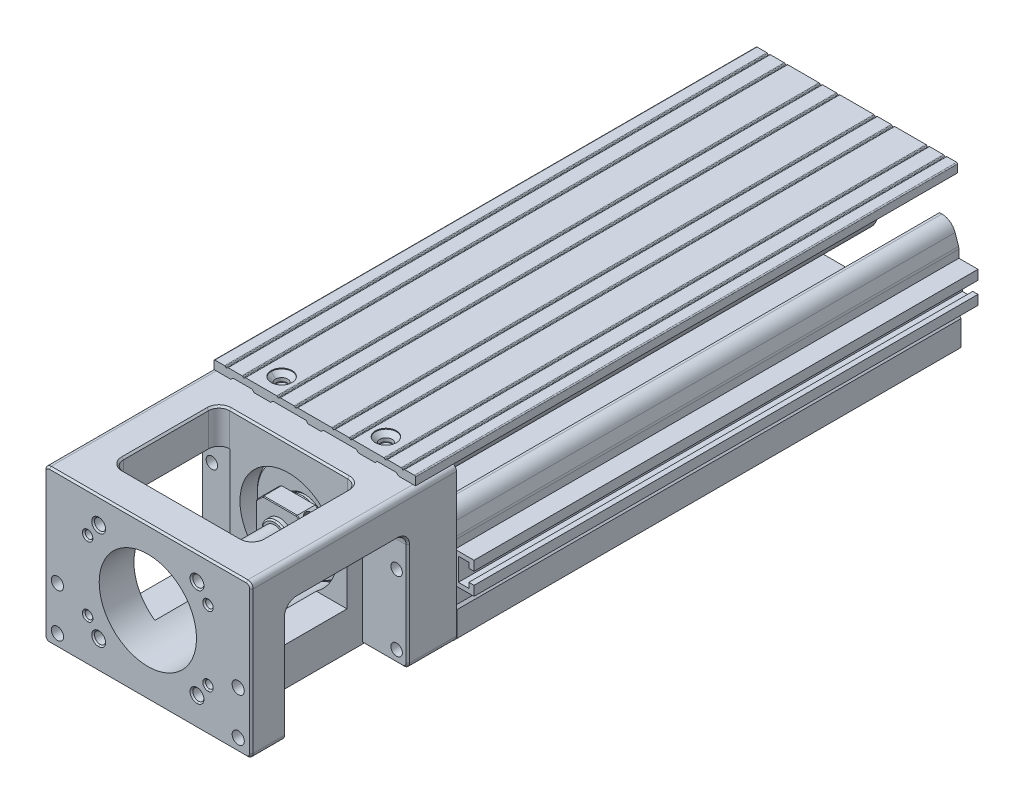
SolidWorks part; units mm, degrees
ref_plane "前视基准面" through (0, 0, 0) normal (0, 0, 1) x (1, 0, 0)
ref_plane "上视基准面" through (0, 0, 0) normal (0, 1, 0) x (1, 0, 0)
ref_plane "右视基准面" through (0, 0, 0) normal (1, 0, 0) x (0, 0, -1)
imported_body "输入1"
sketch "草图1" plane through (0, 0, 90) normal (0, 0, -1) x (-1, 0, 0)
  line L0 (-20.9243, 47) -> (-24.8757, 47) construction
  line L1 (-25.0879, 46.9121) -> (-25.2586, 46.7414) construction
  line L2 (-25.5414, 46.7414) -> (-25.7121, 46.9121) construction
  line L3 (-25.9243, 47) -> (-28.7, 47) construction
  line L4 (-29, 46.7) -> (-29, 44.5) construction
  line L5 (-29, 44.5) -> (-24.1, 44.5) construction
  line L6 (-24.1, 44.5) -> (-23.5, 45.1) construction
  line L7 (-23.5, 45.1) -> (-18, 45.1) construction
  line L8 (-18, 45.1) -> (-17.4, 44.5) construction
  line L9 (-17.4, 44.5) -> (-12.6, 44.5) construction
  line L10 (-12.6, 44.5) -> (-12, 45.1) construction
  line L11 (-12, 45.1) -> (-2.5, 45.1) construction
  line L12 (-2.5, 45.1) -> (-1.9, 44.5) construction
  line L13 (-1.9, 44.5) -> (1.9, 44.5) construction
  line L14 (1.9, 44.5) -> (2.5, 45.1) construction
  line L15 (2.5, 45.1) -> (12, 45.1) construction
  line L16 (12, 45.1) -> (12.6, 44.5) construction
  line L17 (12.6, 44.5) -> (17.4, 44.5) construction
  line L18 (17.4, 44.5) -> (18, 45.1) construction
  line L19 (18, 45.1) -> (23.5, 45.1) construction
  line L20 (23.5, 45.1) -> (24.1, 44.5) construction
  line L21 (24.1, 44.5) -> (29, 44.5) construction
  line L22 (29, 44.5) -> (29, 46.7) construction
  line L23 (28.7, 47) -> (25.9243, 47) construction
  line L24 (25.7121, 46.9121) -> (25.5414, 46.7414) construction
  line L25 (25.2586, 46.7414) -> (25.0879, 46.9121) construction
  line L26 (24.8757, 47) -> (20.9243, 47) construction
  line L27 (20.7121, 46.9121) -> (20.5414, 46.7414) construction
  line L28 (20.2586, 46.7414) -> (20.0879, 46.9121) construction
  line L29 (19.8757, 47) -> (10.9243, 47) construction
  line L30 (10.7121, 46.9121) -> (10.5414, 46.7414) construction
  line L31 (10.2586, 46.7414) -> (10.0879, 46.9121) construction
  line L32 (9.8757, 47) -> (5.9243, 47) construction
  line L33 (5.7121, 46.9121) -> (5.5414, 46.7414) construction
  line L34 (5.2586, 46.7414) -> (5.0879, 46.9121) construction
  line L35 (4.8757, 47) -> (-4.8757, 47) construction
  line L36 (-5.0879, 46.9121) -> (-5.2586, 46.7414) construction
  line L37 (-5.5414, 46.7414) -> (-5.7121, 46.9121) construction
  line L38 (-5.9243, 47) -> (-9.8757, 47) construction
  line L39 (-10.0879, 46.9121) -> (-10.2586, 46.7414) construction
  line L40 (-10.5414, 46.7414) -> (-10.7121, 46.9121) construction
  line L41 (-10.9243, 47) -> (-19.8757, 47) construction
  line L42 (-20.0879, 46.9121) -> (-20.2586, 46.7414) construction
  line L43 (-20.5414, 46.7414) -> (-20.7121, 46.9121) construction
  line L44 (-30, 8.7) -> (-30, 1.5) construction
  line L45 (-30, 1.5) -> (-29, 0.5) construction
  line L46 (-29, 0.5) -> (-25, 0.5) construction
  line L47 (-25, 0.5) -> (-24.5, 0) construction
  line L48 (-24.5, 0) -> (-9.5, 0) construction
  line L49 (-9.5, 0) -> (-9, 0.5) construction
  line L50 (-9, 0.5) -> (9, 0.5) construction
  line L51 (9, 0.5) -> (9.5, 0) construction
  line L52 (9.5, 0) -> (24.5, 0) construction
  line L53 (24.5, 0) -> (25, 0.5) construction
  line L54 (25, 0.5) -> (29, 0.5) construction
  line L55 (29, 0.5) -> (30, 1.5) construction
  line L56 (30, 1.5) -> (30, 8.7) construction
  line L57 (30, 8.7) -> (29.35, 9.35) construction
  line L58 (29.35, 9.35) -> (29.35, 14.4) construction
  line L59 (29.35, 14.4) -> (34.85, 14.4) construction
  line L60 (34.85, 14.4) -> (34.85, 17.15) construction
  line L61 (34.85, 17.15) -> (33.35, 17.15) construction
  line L62 (33.35, 17.15) -> (33.35, 15.65) construction
  line L63 (33.35, 15.65) -> (30.35, 15.65) construction
  line L64 (30.35, 15.65) -> (30.35, 22.15) construction
  line L65 (30.35, 22.15) -> (33.35, 22.15) construction
  line L66 (33.35, 22.15) -> (33.35, 20.65) construction
  line L67 (33.35, 20.65) -> (34.85, 20.65) construction
  line L68 (34.85, 20.65) -> (34.85, 23.4) construction
  line L69 (34.85, 23.4) -> (29.35, 23.4) construction
  line L70 (29.35, 23.4) -> (29.35, 25.6754) construction
  line L71 (29.2474, 26.3079) -> (28.2617, 29.2649) construction
  line L72 (24.467, 32) -> (23.8, 32) construction
  line L73 (23.8, 32) -> (23.8, 22.4) construction
  line L74 (23.8, 22.4) -> (23.45, 22.4) construction
  line L75 (23.45, 22.4) -> (22.45, 21.4) construction
  line L76 (22.45, 21.4) -> (21.45, 22.4) construction
  line L77 (21.45, 22.4) -> (20.15, 22.4) construction
  line L78 (20.15, 22.4) -> (20.15, 15.4) construction
  line L79 (20.15, 15.4) -> (21.45, 15.4) construction
  line L80 (21.45, 15.4) -> (22.45, 16.4) construction
  line L81 (22.45, 16.4) -> (23.45, 15.4) construction
  line L82 (23.45, 15.4) -> (24.85, 15.4) construction
  line L83 (24.85, 15.4) -> (24.85, 10.4) construction
  line L84 (21.35, 6.9) -> (18, 6.9) construction
  line L85 (18, 6.9) -> (18, 4.9) construction
  line L86 (18, 4.9) -> (-18, 4.9) construction
  line L87 (-18, 4.9) -> (-18, 6.9) construction
  line L88 (-18, 6.9) -> (-21.35, 6.9) construction
  line L89 (-24.85, 10.4) -> (-24.85, 15.4) construction
  line L90 (-24.85, 15.4) -> (-23.45, 15.4) construction
  line L91 (-23.45, 15.4) -> (-22.45, 16.4) construction
  line L92 (-22.45, 16.4) -> (-21.45, 15.4) construction
  line L93 (-21.45, 15.4) -> (-20.15, 15.4) construction
  line L94 (-20.15, 15.4) -> (-20.15, 22.4) construction
  line L95 (-20.15, 22.4) -> (-21.45, 22.4) construction
  line L96 (-21.45, 22.4) -> (-22.45, 21.4) construction
  line L97 (-22.45, 21.4) -> (-23.45, 22.4) construction
  line L98 (-23.45, 22.4) -> (-23.8, 22.4) construction
  line L99 (-23.8, 22.4) -> (-23.8, 32) construction
  line L100 (-23.8, 32) -> (-24.467, 32) construction
  line L101 (-28.2617, 29.2649) -> (-29.2474, 26.3079) construction
  line L102 (-29.35, 25.6754) -> (-29.35, 23.4) construction
  line L103 (-29.35, 23.4) -> (-34.85, 23.4) construction
  line L104 (-34.85, 23.4) -> (-34.85, 20.65) construction
  line L105 (-34.85, 20.65) -> (-33.35, 20.65) construction
  line L106 (-33.35, 20.65) -> (-33.35, 22.15) construction
  line L107 (-33.35, 22.15) -> (-30.35, 22.15) construction
  line L108 (-30.35, 22.15) -> (-30.35, 15.65) construction
  line L109 (-30.35, 15.65) -> (-33.35, 15.65) construction
  line L110 (-33.35, 15.65) -> (-33.35, 17.15) construction
  line L111 (-33.35, 17.15) -> (-34.85, 17.15) construction
  line L112 (-34.85, 17.15) -> (-34.85, 14.4) construction
  line L113 (-34.85, 14.4) -> (-29.35, 14.4) construction
  line L114 (-29.35, 14.4) -> (-29.35, 9.35) construction
  line L115 (-29.35, 9.35) -> (-30, 8.7) construction
  line L116 (-20.9243, 47) -> (-24.8757, 47)
  line L117 (-25.0879, 46.9121) -> (-25.2586, 46.7414)
  line L118 (-25.5414, 46.7414) -> (-25.7121, 46.9121)
  line L119 (-25.9243, 47) -> (-28.7, 47)
  line L120 (-29, 46.7) -> (-29, 44.5)
  line L121 (-29, 44.5) -> (-24.1, 44.5)
  line L122 (-24.1, 44.5) -> (-23.5, 45.1)
  line L123 (-23.5, 45.1) -> (-18, 45.1)
  line L124 (-18, 45.1) -> (-17.4, 44.5)
  line L125 (-17.4, 44.5) -> (-12.6, 44.5)
  line L126 (-12.6, 44.5) -> (-12, 45.1)
  line L127 (-12, 45.1) -> (-2.5, 45.1)
  line L128 (-2.5, 45.1) -> (-1.9, 44.5)
  line L129 (-1.9, 44.5) -> (1.9, 44.5)
  line L130 (1.9, 44.5) -> (2.5, 45.1)
  line L131 (2.5, 45.1) -> (12, 45.1)
  line L132 (12, 45.1) -> (12.6, 44.5)
  line L133 (12.6, 44.5) -> (17.4, 44.5)
  line L134 (17.4, 44.5) -> (18, 45.1)
  line L135 (18, 45.1) -> (23.5, 45.1)
  line L136 (23.5, 45.1) -> (24.1, 44.5)
  line L137 (24.1, 44.5) -> (29, 44.5)
  line L138 (29, 44.5) -> (29, 46.7)
  line L139 (28.7, 47) -> (25.9243, 47)
  line L140 (25.7121, 46.9121) -> (25.5414, 46.7414)
  line L141 (25.2586, 46.7414) -> (25.0879, 46.9121)
  line L142 (24.8757, 47) -> (20.9243, 47)
  line L143 (20.7121, 46.9121) -> (20.5414, 46.7414)
  line L144 (20.2586, 46.7414) -> (20.0879, 46.9121)
  line L145 (19.8757, 47) -> (10.9243, 47)
  line L146 (10.7121, 46.9121) -> (10.5414, 46.7414)
  line L147 (10.2586, 46.7414) -> (10.0879, 46.9121)
  line L148 (9.8757, 47) -> (5.9243, 47)
  line L149 (5.7121, 46.9121) -> (5.5414, 46.7414)
  line L150 (5.2586, 46.7414) -> (5.0879, 46.9121)
  line L151 (4.8757, 47) -> (-4.8757, 47)
  line L152 (-5.0879, 46.9121) -> (-5.2586, 46.7414)
  line L153 (-5.5414, 46.7414) -> (-5.7121, 46.9121)
  line L154 (-5.9243, 47) -> (-9.8757, 47)
  line L155 (-10.0879, 46.9121) -> (-10.2586, 46.7414)
  line L156 (-10.5414, 46.7414) -> (-10.7121, 46.9121)
  line L157 (-10.9243, 47) -> (-19.8757, 47)
  line L158 (-20.0879, 46.9121) -> (-20.2586, 46.7414)
  line L159 (-20.5414, 46.7414) -> (-20.7121, 46.9121)
  line L160 (-30, 8.7) -> (-30, 1.5)
  line L161 (-30, 1.5) -> (-29, 0.5)
  line L162 (-29, 0.5) -> (-25, 0.5)
  line L163 (-25, 0.5) -> (-24.5, 0)
  line L164 (-24.5, 0) -> (-9.5, 0)
  line L165 (-9.5, 0) -> (-9, 0.5)
  line L166 (-9, 0.5) -> (9, 0.5)
  line L167 (9, 0.5) -> (9.5, 0)
  line L168 (9.5, 0) -> (24.5, 0)
  line L169 (24.5, 0) -> (25, 0.5)
  line L170 (25, 0.5) -> (29, 0.5)
  line L171 (29, 0.5) -> (30, 1.5)
  line L172 (30, 1.5) -> (30, 8.7)
  line L173 (30, 8.7) -> (29.35, 9.35)
  line L174 (29.35, 9.35) -> (29.35, 14.4)
  line L175 (29.35, 14.4) -> (34.85, 14.4)
  line L176 (34.85, 14.4) -> (34.85, 17.15)
  line L177 (34.85, 17.15) -> (33.35, 17.15)
  line L178 (33.35, 17.15) -> (33.35, 15.65)
  line L179 (33.35, 15.65) -> (30.35, 15.65)
  line L180 (30.35, 15.65) -> (30.35, 22.15)
  line L181 (30.35, 22.15) -> (33.35, 22.15)
  line L182 (33.35, 22.15) -> (33.35, 20.65)
  line L183 (33.35, 20.65) -> (34.85, 20.65)
  line L184 (34.85, 20.65) -> (34.85, 23.4)
  line L185 (34.85, 23.4) -> (29.35, 23.4)
  line L186 (29.35, 23.4) -> (29.35, 25.6754)
  line L187 (29.2474, 26.3079) -> (28.2617, 29.2649)
  line L188 (24.467, 32) -> (23.8, 32)
  line L189 (23.8, 32) -> (23.8, 22.4)
  line L190 (23.8, 22.4) -> (23.45, 22.4)
  line L191 (23.45, 22.4) -> (22.45, 21.4)
  line L192 (22.45, 21.4) -> (21.45, 22.4)
  line L193 (21.45, 22.4) -> (20.15, 22.4)
  line L194 (20.15, 22.4) -> (20.15, 15.4)
  line L195 (20.15, 15.4) -> (21.45, 15.4)
  line L196 (21.45, 15.4) -> (22.45, 16.4)
  line L197 (22.45, 16.4) -> (23.45, 15.4)
  line L198 (23.45, 15.4) -> (24.85, 15.4)
  line L199 (24.85, 15.4) -> (24.85, 10.4)
  line L200 (21.35, 6.9) -> (18, 6.9)
  line L201 (18, 6.9) -> (18, 4.9)
  line L202 (18, 4.9) -> (-18, 4.9)
  line L203 (-18, 4.9) -> (-18, 6.9)
  line L204 (-18, 6.9) -> (-21.35, 6.9)
  line L205 (-24.85, 10.4) -> (-24.85, 15.4)
  line L206 (-24.85, 15.4) -> (-23.45, 15.4)
  line L207 (-23.45, 15.4) -> (-22.45, 16.4)
  line L208 (-22.45, 16.4) -> (-21.45, 15.4)
  line L209 (-21.45, 15.4) -> (-20.15, 15.4)
  line L210 (-20.15, 15.4) -> (-20.15, 22.4)
  line L211 (-20.15, 22.4) -> (-21.45, 22.4)
  line L212 (-21.45, 22.4) -> (-22.45, 21.4)
  line L213 (-22.45, 21.4) -> (-23.45, 22.4)
  line L214 (-23.45, 22.4) -> (-23.8, 22.4)
  line L215 (-23.8, 22.4) -> (-23.8, 32)
  line L216 (-23.8, 32) -> (-24.467, 32)
  line L217 (-28.2617, 29.2649) -> (-29.2474, 26.3079)
  line L218 (-29.35, 25.6754) -> (-29.35, 23.4)
  line L219 (-29.35, 23.4) -> (-34.85, 23.4)
  line L220 (-34.85, 23.4) -> (-34.85, 20.65)
  line L221 (-34.85, 20.65) -> (-33.35, 20.65)
  line L222 (-33.35, 20.65) -> (-33.35, 22.15)
  line L223 (-33.35, 22.15) -> (-30.35, 22.15)
  line L224 (-30.35, 22.15) -> (-30.35, 15.65)
  line L225 (-30.35, 15.65) -> (-33.35, 15.65)
  line L226 (-33.35, 15.65) -> (-33.35, 17.15)
  line L227 (-33.35, 17.15) -> (-34.85, 17.15)
  line L228 (-34.85, 17.15) -> (-34.85, 14.4)
  line L229 (-34.85, 14.4) -> (-29.35, 14.4)
  line L230 (-29.35, 14.4) -> (-29.35, 9.35)
  line L231 (-29.35, 9.35) -> (-30, 8.7)
  arc A0 (-24.8757, 47) -> (-25.0879, 46.9121) centre (-24.8757, 46.7) ccw construction
  arc A1 (-25.5414, 46.7414) -> (-25.2586, 46.7414) centre (-25.4, 46.8828) ccw construction
  arc A2 (-25.7121, 46.9121) -> (-25.9243, 47) centre (-25.9243, 46.7) ccw construction
  arc A3 (-28.7, 47) -> (-29, 46.7) centre (-28.7, 46.7) ccw construction
  arc A4 (29, 46.7) -> (28.7, 47) centre (28.7, 46.7) ccw construction
  arc A5 (25.9243, 47) -> (25.7121, 46.9121) centre (25.9243, 46.7) ccw construction
  arc A6 (25.2586, 46.7414) -> (25.5414, 46.7414) centre (25.4, 46.8828) ccw construction
  arc A7 (25.0879, 46.9121) -> (24.8757, 47) centre (24.8757, 46.7) ccw construction
  arc A8 (20.9243, 47) -> (20.7121, 46.9121) centre (20.9243, 46.7) ccw construction
  arc A9 (20.2586, 46.7414) -> (20.5414, 46.7414) centre (20.4, 46.8828) ccw construction
  arc A10 (20.0879, 46.9121) -> (19.8757, 47) centre (19.8757, 46.7) ccw construction
  arc A11 (10.9243, 47) -> (10.7121, 46.9121) centre (10.9243, 46.7) ccw construction
  arc A12 (10.2586, 46.7414) -> (10.5414, 46.7414) centre (10.4, 46.8828) ccw construction
  arc A13 (10.0879, 46.9121) -> (9.8757, 47) centre (9.8757, 46.7) ccw construction
  arc A14 (5.9243, 47) -> (5.7121, 46.9121) centre (5.9243, 46.7) ccw construction
  arc A15 (5.2586, 46.7414) -> (5.5414, 46.7414) centre (5.4, 46.8828) ccw construction
  arc A16 (5.0879, 46.9121) -> (4.8757, 47) centre (4.8757, 46.7) ccw construction
  arc A17 (-4.8757, 47) -> (-5.0879, 46.9121) centre (-4.8757, 46.7) ccw construction
  arc A18 (-5.5414, 46.7414) -> (-5.2586, 46.7414) centre (-5.4, 46.8828) ccw construction
  arc A19 (-5.7121, 46.9121) -> (-5.9243, 47) centre (-5.9243, 46.7) ccw construction
  arc A20 (-9.8757, 47) -> (-10.0879, 46.9121) centre (-9.8757, 46.7) ccw construction
  arc A21 (-10.5414, 46.7414) -> (-10.2586, 46.7414) centre (-10.4, 46.8828) ccw construction
  arc A22 (-10.7121, 46.9121) -> (-10.9243, 47) centre (-10.9243, 46.7) ccw construction
  arc A23 (-19.8757, 47) -> (-20.0879, 46.9121) centre (-19.8757, 46.7) ccw construction
  arc A24 (-20.5414, 46.7414) -> (-20.2586, 46.7414) centre (-20.4, 46.8828) ccw construction
  arc A25 (-20.7121, 46.9121) -> (-20.9243, 47) centre (-20.9243, 46.7) ccw construction
  circle A26 centre (0, 23) radius 6 construction
  arc A27 (29.35, 25.6754) -> (29.2474, 26.3079) centre (27.35, 25.6754) ccw construction
  arc A28 (28.2617, 29.2649) -> (24.467, 32) centre (24.467, 28) ccw construction
  arc A29 (21.35, 6.9) -> (24.85, 10.4) centre (21.35, 10.4) ccw construction
  arc A30 (-24.85, 10.4) -> (-21.35, 6.9) centre (-21.35, 10.4) ccw construction
  arc A31 (-24.467, 32) -> (-28.2617, 29.2649) centre (-24.467, 28) ccw construction
  arc A32 (-29.2474, 26.3079) -> (-29.35, 25.6754) centre (-27.35, 25.6754) ccw construction
  arc A33 (-24.8757, 47) -> (-25.0879, 46.9121) centre (-24.8757, 46.7) ccw
  arc A34 (-25.5414, 46.7414) -> (-25.2586, 46.7414) centre (-25.4, 46.8828) ccw
  arc A35 (-25.7121, 46.9121) -> (-25.9243, 47) centre (-25.9243, 46.7) ccw
  arc A36 (-28.7, 47) -> (-29, 46.7) centre (-28.7, 46.7) ccw
  arc A37 (29, 46.7) -> (28.7, 47) centre (28.7, 46.7) ccw
  arc A38 (25.9243, 47) -> (25.7121, 46.9121) centre (25.9243, 46.7) ccw
  arc A39 (25.2586, 46.7414) -> (25.5414, 46.7414) centre (25.4, 46.8828) ccw
  arc A40 (25.0879, 46.9121) -> (24.8757, 47) centre (24.8757, 46.7) ccw
  arc A41 (20.9243, 47) -> (20.7121, 46.9121) centre (20.9243, 46.7) ccw
  arc A42 (20.2586, 46.7414) -> (20.5414, 46.7414) centre (20.4, 46.8828) ccw
  arc A43 (20.0879, 46.9121) -> (19.8757, 47) centre (19.8757, 46.7) ccw
  arc A44 (10.9243, 47) -> (10.7121, 46.9121) centre (10.9243, 46.7) ccw
  arc A45 (10.2586, 46.7414) -> (10.5414, 46.7414) centre (10.4, 46.8828) ccw
  arc A46 (10.0879, 46.9121) -> (9.8757, 47) centre (9.8757, 46.7) ccw
  arc A47 (5.9243, 47) -> (5.7121, 46.9121) centre (5.9243, 46.7) ccw
  arc A48 (5.2586, 46.7414) -> (5.5414, 46.7414) centre (5.4, 46.8828) ccw
  arc A49 (5.0879, 46.9121) -> (4.8757, 47) centre (4.8757, 46.7) ccw
  arc A50 (-4.8757, 47) -> (-5.0879, 46.9121) centre (-4.8757, 46.7) ccw
  arc A51 (-5.5414, 46.7414) -> (-5.2586, 46.7414) centre (-5.4, 46.8828) ccw
  arc A52 (-5.7121, 46.9121) -> (-5.9243, 47) centre (-5.9243, 46.7) ccw
  arc A53 (-9.8757, 47) -> (-10.0879, 46.9121) centre (-9.8757, 46.7) ccw
  arc A54 (-10.5414, 46.7414) -> (-10.2586, 46.7414) centre (-10.4, 46.8828) ccw
  arc A55 (-10.7121, 46.9121) -> (-10.9243, 47) centre (-10.9243, 46.7) ccw
  arc A56 (-19.8757, 47) -> (-20.0879, 46.9121) centre (-19.8757, 46.7) ccw
  arc A57 (-20.5414, 46.7414) -> (-20.2586, 46.7414) centre (-20.4, 46.8828) ccw
  arc A58 (-20.7121, 46.9121) -> (-20.9243, 47) centre (-20.9243, 46.7) ccw
  circle A59 centre (0, 23) radius 6
  arc A60 (29.35, 25.6754) -> (29.2474, 26.3079) centre (27.35, 25.6754) ccw
  arc A61 (28.2617, 29.2649) -> (24.467, 32) centre (24.467, 28) ccw
  arc A62 (21.35, 6.9) -> (24.85, 10.4) centre (21.35, 10.4) ccw
  arc A63 (-24.85, 10.4) -> (-21.35, 6.9) centre (-21.35, 10.4) ccw
  arc A64 (-24.467, 32) -> (-28.2617, 29.2649) centre (-24.467, 28) ccw
  arc A65 (-29.2474, 26.3079) -> (-29.35, 25.6754) centre (-27.35, 25.6754) ccw
extrude "凸台-拉伸1" add sketch "草图1" along normal blind 135
hole_wizard "打孔尺寸(%根据)内六角圆柱头螺钉的类型1" positions "草图2" profile "草图3" counterbore size "M5" standard "GB"
sketch "草图2" plane through (0, 4.9, 0) normal (0, 1, 0) x (1, 0, 0)
  line L0 (0, 0) -> (0, -51.0625) construction
  line L1 (34.85, -100) -> (29.8, -100) construction
  point P0 (-15, -75)
  point P7 (15, -75)
  point P10 (-15, 25)
  point P12 (-15, 125)
  point P14 (-15, 225)
  point P16 (-15, 325)
  point P18 (-15, 425)
  point P20 (-15, 525)
  point P24 (15, 525)
  point P25 (15, 425)
  point P26 (15, 325)
  point P27 (15, 225)
  point P28 (15, 125)
  point P29 (15, 25)
  dimension "D1" = 30
  dimension "D2" = 25
  dimension "D3" = 100
  dimension "D4" = 100
  dimension "D5" = 100
  dimension "D6" = 100
  dimension "D7" = 100
  dimension "D8" = 100
sketch "草图3" plane through (-15, 4.9, 75) normal (1, 0, 0) x (0, 0, 1)
  line L0 (0, 0) -> (0, 4.9)
  line L1 (0, 4.9) -> (2.75, 4.9)
  line L3 (2.75, 4.9) -> (2.75, 4)
  line L4 (2.75, 4) -> (4.75, 4)
  line L5 (4.75, 4) -> (4.75, 0)
  line L7 (4.75, 0) -> (0, 0)
  line L11 (0, -6.35) -> (0, 107.95) construction
  dimension "通孔孔直径" = 5.5
  dimension "通孔孔深度" = 4.9
  dimension "柱形沉头孔直径" = 9.5
  dimension "柱形沉头孔深度" = 4
